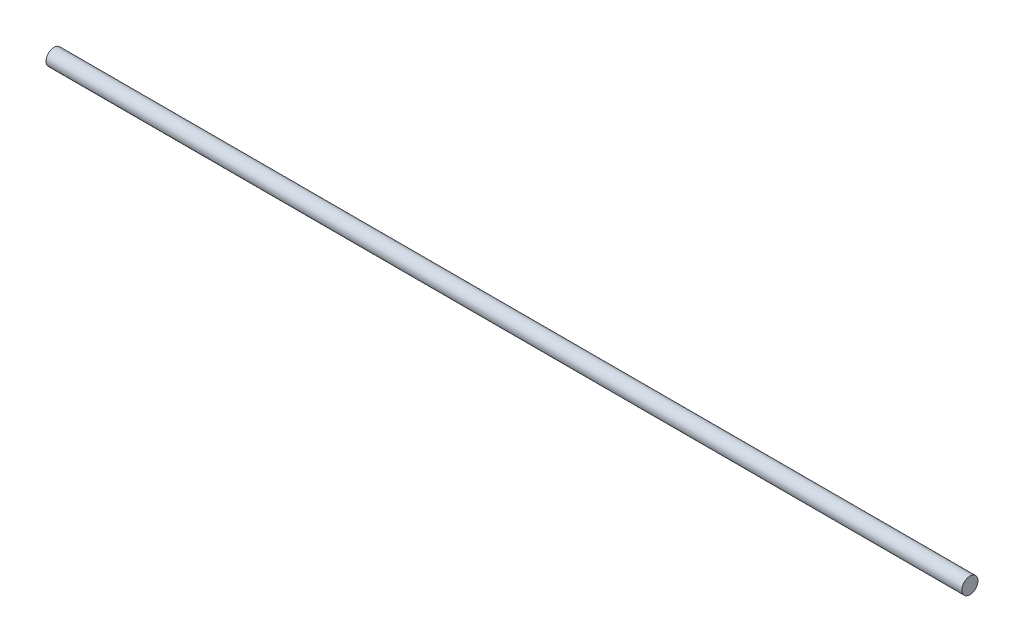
SolidWorks part; units mm, degrees
ref_plane "Front Plane" through (0, 0, 0) normal (0, 0, 1) x (1, 0, 0)
ref_plane "Top Plane" through (0, 0, 0) normal (0, 1, 0) x (1, 0, 0)
ref_plane "Right Plane" through (0, 0, 0) normal (1, 0, 0) x (0, 0, -1)
other "Configuration Table"
sketch "Sketch1" plane through (0, 0, 0) normal (1, 0, 0) x (0, 0, -1)
  circle A0 centre (0, 0) radius 7.6
  dimension "D1" = 15.2
extrude "Extrude1" add sketch "Sketch1" along normal mid plane 863.6
